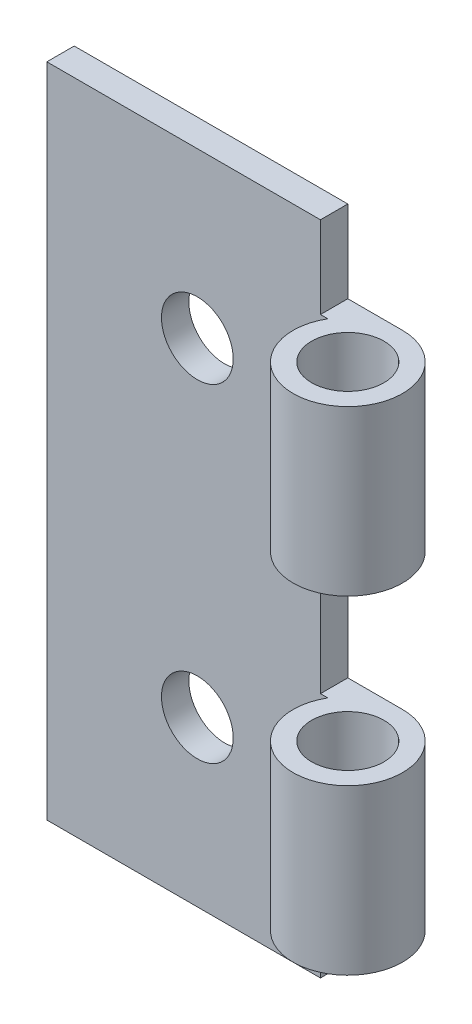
SolidWorks part; units mm, degrees
ref_plane "Front"
ref_plane "Top" through (0, 0, 0) normal (0, 1, 0) x (1, 0, 0)
ref_plane "Right" through (0, 0, 0) normal (1, 0, 0) x (0, 0, -1)
sketch "Sketch1" plane through (0, 0, 0) normal (0, 0, 1) x (1, 0, 0)
  line L1 (0, 0) -> (-38.1, 0)
  line L2 (0, 0) -> (0, 76.2)
  line L3 (0, 76.2) -> (-38.1, 76.2)
  line L4 (-38.1, 0) -> (-38.1, 76.2)
  dimension "D1" = 76.2
  dimension "D2" = 38.1
extrude "Base-Extrude" add sketch "Sketch1" against normal blind 3.175
sketch "Sketch2" plane through (0, 0, 0) normal (0, 0, 1) x (1, 0, 0)
  line L0 (-38.1, 76.2) -> (-38.1, 0) construction
  line L1 (0, 76.2) -> (-38.1, 76.2) construction
  circle A0 centre (-20.6375, 57.15) radius 4.1656
  dimension "D1" = 8.3312
  dimension "D2" = 17.4625
  dimension "D3" = 19.05
extrude "Cut-Extrude1" cut sketch "Sketch2" against normal through all
sketch "Sketch3" plane through (0, 0, 0) normal (0, 0, 1) x (1, 0, 0)
  line L0 (-38.1, 0) -> (0, 0) construction
  line L1 (-38.1, 76.2) -> (-38.1, 0) construction
  circle A0 centre (-20.6375, 19.05) radius 4.1656
  dimension "D1" = 8.3312
  dimension "D2" = 19.05
  dimension "D3" = 17.4625
extrude "Cut-Extrude2" cut sketch "Sketch3" against normal through all
sketch "Sketch4" plane through (0, 0, 0) normal (0, -1, 0) x (1, 0, 0)
  line L0 (-38.1, -3.175) -> (0, -3.175) construction
  circle A0 centre (0, 3.175) radius 6.35
  dimension "D1" = 12.7
extrude "Boss-Extrude1" add sketch "Sketch4" against normal up to vertex
sketch "Sketch5" plane through (0, 0, 0) normal (0, -1, 0) x (1, 0, 0)
  circle A0 centre (0, 3.175) radius 4.191
  dimension "D1" = 8.382
extrude "Cut-Extrude3" cut sketch "Sketch5" against normal up to vertex
sketch "Sketch9" plane through (0, 0, 0) normal (0, 0, 1) x (1, 0, 0)
  line L0 (6.35, 76.2) -> (-6.35, 76.2)
  line L1 (6.35, 76.2) -> (-6.35, 76.2) construction
  line L2 (-6.35, 76.2) -> (-6.35, 0) construction
  line L3 (-6.35, 76.2) -> (-6.35, 66.675)
  line L4 (-6.35, 66.675) -> (10.8171, 66.675)
  dimension "D1" = 9.525
extrude "Cut-Extrude6" cut sketch "Sketch9" against normal through all and the other way through all
sketch "Sketch10" plane through (0, 0, 0) normal (0, 0, 1) x (1, 0, 0)
  line L0 (8.4369, 0) -> (-6.35, 0)
  line L1 (-6.35, 66.675) -> (-6.35, 0) construction
  line L2 (-6.35, 0) -> (-6.35, 9.525)
  line L3 (-6.35, 9.525) -> (8.4369, 9.525)
  dimension "D1" = 9.525
extrude "Cut-Extrude7" cut sketch "Sketch10" against normal through all and the other way through all flip side to cut
sketch "Sketch11" plane through (0, 0, 0) normal (0, 0, 1) x (1, 0, 0)
  line L0 (8.0969, 47.625) -> (-6.35, 47.625)
  line L1 (-6.35, 66.675) -> (-6.35, 9.525) construction
  line L2 (-6.35, 47.625) -> (-6.35, 28.575)
  line L3 (-6.35, 28.575) -> (8.0969, 28.575)
  line L4 (-6.35, 9.525) -> (6.35, 9.525) construction
  line L5 (6.35, 66.675) -> (-6.35, 66.675) construction
  dimension "D1" = 19.05
  dimension "D2" = 19.05
extrude "Cut-Extrude8" cut sketch "Sketch11" against normal through all and the other way through all
